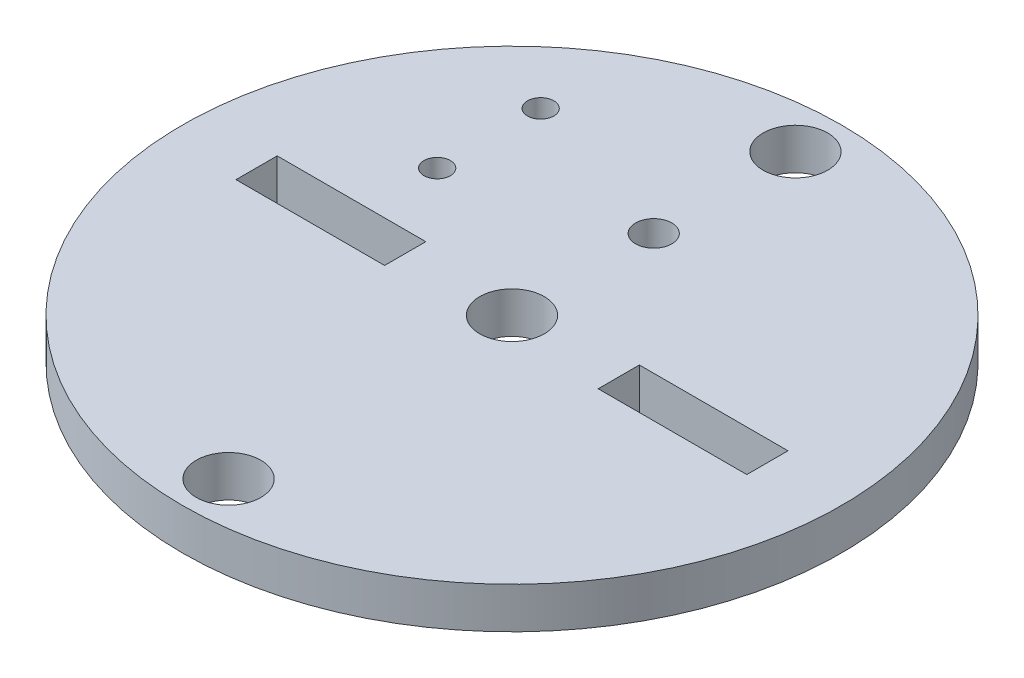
SolidWorks part; units mm, degrees
ref_plane "Front Plane" through (0, 0, 0) normal (0, 0, 1) x (1, 0, 0)
ref_plane "Top Plane" through (0, 0, 0) normal (0, 1, 0) x (1, 0, 0)
ref_plane "Right Plane" through (0, 0, 0) normal (1, 0, 0) x (0, 0, -1)
sketch "Sketch1" plane through (0, 0, 0) normal (0, 1, 0) x (1, 0, 0)
  circle A0 centre (0, 0) radius 25.4
  dimension "D1" = 50.8
extrude "Boss-Extrude1" add sketch "Sketch1" along normal blind 3.175
hole_wizard "#10 Clearance Hole1" positions "Sketch3" profile "Sketch4" hole size "#10" standard "ANSI Inch"
sketch "Sketch3" plane through (0, 3.175, 0) normal (0, 1, 0) x (1, 0, 0)
  line L0 (-25.4, 0) -> (25.4, 0) construction
  line L2 (0, 25.4) -> (0, -25.4) construction
  circle A0 centre (0, 0) radius 25.4 construction
  point P0 (0, 0)
  point P28 (0, 21.844)
  point P29 (0, -21.844)
  dimension "D1" = 21.844
sketch "Sketch4" plane through (0, 3.175, 0) normal (1, 0, 0) x (0, 0, 1)
  line L0 (0, 0) -> (0, 3.175)
  line L1 (0, 3.175) -> (2.4892, 3.175)
  line L2 (2.4892, 3.175) -> (2.4892, 0)
  line L5 (2.4892, 0) -> (0, 0)
  line L11 (0, -6.35) -> (0, 107.95) construction
  dimension "Thru Hole Dia." = 4.9784
  dimension "Thru Hole Depth" = 3.175
sketch "Sketch5" plane through (0, 3.175, 0) normal (0, 1, 0) x (1, 0, 0)
  line L0 (0, -25.4) -> (0, 25.4) construction
  line L1 (-25.4, 0) -> (25.4, 0) construction
  line L2 (-8.2296, -1.5875) -> (-19.685, 1.5875) construction
  line L3 (8.2296, 1.5875) -> (19.685, 1.5875)
  line L4 (8.2296, 1.5875) -> (8.2296, -1.5875)
  line L5 (8.2296, -1.5875) -> (19.685, -1.5875)
  line L6 (19.685, 1.5875) -> (19.685, -1.5875)
  line L7 (8.2296, 1.5875) -> (19.685, -1.5875) construction
  line L8 (8.2296, -1.5875) -> (19.685, 1.5875) construction
  line L9 (-8.2296, 1.5875) -> (-19.685, -1.5875) construction
  line L10 (-19.685, 1.5875) -> (-19.685, -1.5875)
  line L11 (-8.2296, -1.5875) -> (-19.685, -1.5875)
  line L12 (-8.2296, 1.5875) -> (-8.2296, -1.5875)
  line L13 (-8.2296, 1.5875) -> (-19.685, 1.5875)
  circle A0 centre (0, 0) radius 25.4 construction
  point P7 (13.9573, 0)
  point P17 (-13.9573, 0)
extrude "Cut-Extrude1" cut sketch "Sketch5" against normal through all
sketch "Sketch6" plane through (0, 3.175, 0) normal (0, 1, 0) x (1, 0, 0)
  line L0 (0, -25.4) -> (0, 25.4) construction
  line L1 (-25.4, 0) -> (25.4, 0) construction
  line L2 (0, 10.922) -> (-19.68, 10.922) construction
  line L3 (-12.7, 18.7691) -> (-12.7, 3.2999) construction
  circle A0 centre (0, 0) radius 25.4 construction
  circle A1 centre (0, 10.922) radius 1.397
  circle A2 centre (-12.7, 14.9098) radius 1.016
  circle A3 centre (-12.7, 6.9342) radius 1.016
  dimension "D1" = 10.922
  dimension "D2" = 2.794
  dimension "D4" = 3.9878
  dimension "D5" = 2.032
  dimension "D3" = 12.7
extrude "Cut-Extrude2" cut sketch "Sketch6" against normal through all
sketch "Sketch8" plane through (0, 3.175, 0) normal (0, 1, 0) x (1, 0, 0)
  line L8 (-8.3312, -1.4859) -> (-8.3312, 1.4859)
  line L9 (-19.5834, -1.4859) -> (-8.3312, -1.4859)
  line L10 (-19.5834, 1.4859) -> (-19.5834, -1.4859)
  line L11 (-8.3312, 1.4859) -> (-19.5834, 1.4859)
  line L12 (-8.3312, -1.4859) -> (-8.3312, 1.4859)
  line L13 (-19.5834, -1.4859) -> (-8.3312, -1.4859)
  line L14 (-19.5834, 1.4859) -> (-19.5834, -1.4859)
  line L15 (-8.3312, 1.4859) -> (-19.5834, 1.4859)
  line L20 (8.3312, 1.4859) -> (8.3312, -1.4859)
  line L21 (19.5834, 1.4859) -> (8.3312, 1.4859)
  line L22 (19.5834, -1.4859) -> (19.5834, 1.4859)
  line L23 (8.3312, -1.4859) -> (19.5834, -1.4859)
  line L24 (8.3312, 1.4859) -> (8.3312, -1.4859)
  line L25 (19.5834, 1.4859) -> (8.3312, 1.4859)
  line L26 (19.5834, -1.4859) -> (19.5834, 1.4859)
  line L27 (8.3312, -1.4859) -> (19.5834, -1.4859)
  circle A2 centre (0, 0) radius 25.5016
  circle A3 centre (0, 0) radius 25.5016
  circle A5 centre (0, 21.844) radius 2.3876
  circle A6 centre (0, 21.844) radius 2.3876
  circle A8 centre (-12.7, 14.9098) radius 0.9144
  circle A9 centre (-12.7, 14.9098) radius 0.9144
  circle A11 centre (0, 10.922) radius 1.2954
  circle A12 centre (0, 10.922) radius 1.2954
  circle A14 centre (-12.7, 6.9342) radius 0.9144
  circle A15 centre (-12.7, 6.9342) radius 0.9144
  circle A17 centre (0, 0) radius 2.3876
  circle A18 centre (0, 0) radius 2.3876
  circle A20 centre (0, -21.844) radius 2.3876
  circle A21 centre (0, -21.844) radius 2.3876
equation "\"t\" = .125in'plywood thickness"
equation "\"kerf\"= .004in'laser cutter kerf"
equation "\"D1@Boss-Extrude1\"=\"t\""
equation "\"D3@Sketch5\"=\"t\""
equation "\"D1@Sketch8\"=\"kerf\""
equation "\"D2@Sketch8\"=\"kerf\""
equation "\"D3@Sketch8\"=\"kerf\""
equation "\"D4@Sketch8\"=\"kerf\""
equation "\"D5@Sketch8\"=\"kerf\""
equation "\"D6@Sketch8\"=\"kerf\""
equation "\"D7@Sketch8\"=\"kerf\""
equation "\"D8@Sketch8\"=\"kerf\""
equation "\"D9@Sketch8\"=\"kerf\""
